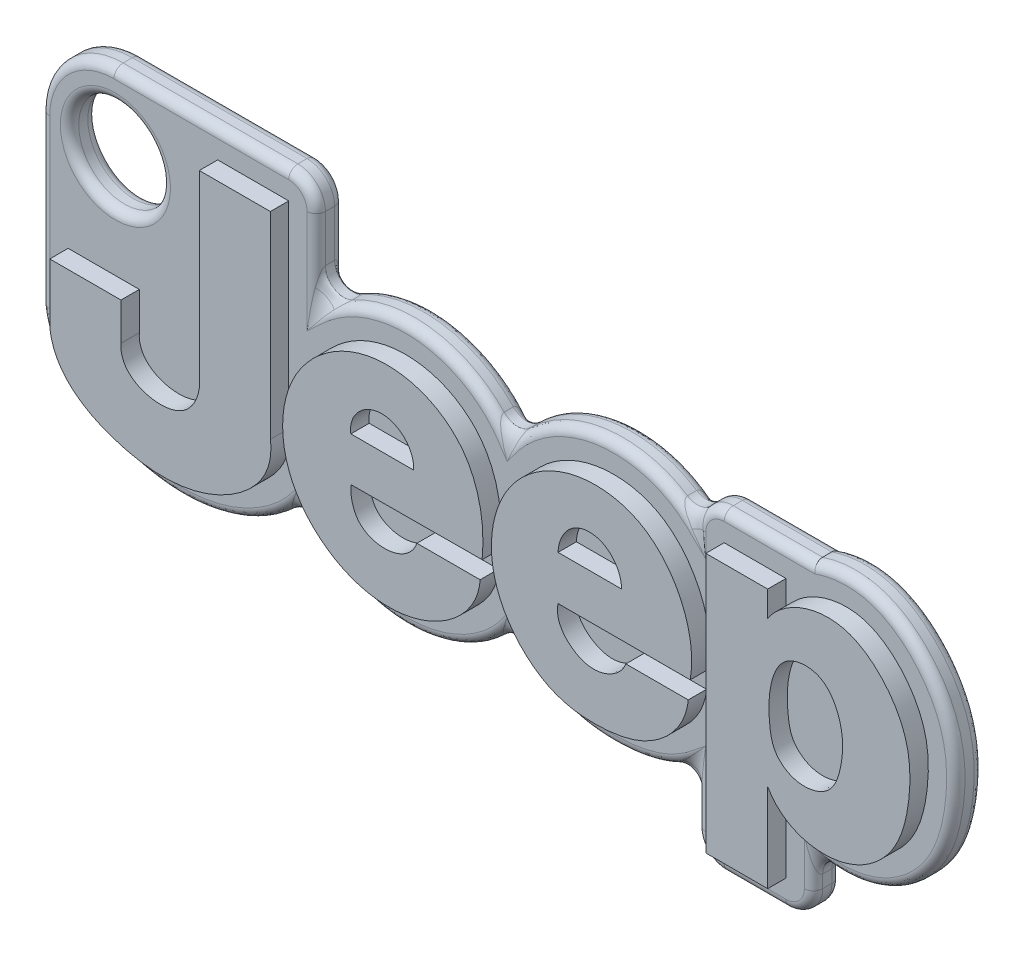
SolidWorks part; units mm, degrees
ref_plane "Front Plane" through (0, 0, 0) normal (0, 0, 1) x (1, 0, 0)
ref_plane "Top Plane" through (0, 0, 0) normal (0, 1, 0) x (1, 0, 0)
ref_plane "Right Plane" through (0, 0, 0) normal (1, 0, 0) x (0, 0, -1)
sketch "Sketch1" plane through (0, 0, 0) normal (0, 0, 1) x (1, 0, 0)
  line L0 (-6.9158, -4.9188) -> (-0.025, -4.9188)
  line L1 (-14.117, -2.9772) -> (0.1939, -2.9168)
  line L2 (-7.2782, 1.8065) -> (-14.117, 1.8065)
  line L3 (-46.9381, -4.6232) -> (-46.9381, 1.9133)
  line L4 (-46.9381, 1.9133) -> (-39.1769, 1.9133)
  line L5 (-39.1769, 1.9133) -> (-39.1769, -2.1628)
  line L6 (-30.6332, -0.8399) -> (-30.6332, 18.4136)
  line L7 (-30.6332, 18.4136) -> (-22.8911, 18.4136)
  line L8 (-22.8911, 18.4136) -> (-22.8911, -3.0998)
  line L9 (8.4713, -2.9168) -> (22.878, -2.9168)
  line L10 (22.6596, -4.9188) -> (15.8616, -4.9188)
  line L11 (8.4713, 1.9133) -> (15.3868, 1.9133)
  line L12 (31.321, -8.7806) -> (31.321, -18.4136)
  line L13 (31.321, -18.4136) -> (24.5768, -18.4136)
  line L14 (24.5768, -18.4136) -> (24.5768, 9.8752)
  line L15 (24.5768, 9.8752) -> (31.321, 9.8752)
  line L16 (31.321, 9.8752) -> (31.321, 7.1086)
  spline S0 degree 3 poles (-30.6332, -0.8399) (-30.4221, -2.2688) (-31.4077, -5.3573) (-36.3466, -6.279) (-39.3453, -4.2998) (-39.1769, -2.1628) knots 0 0 0 0 0.330374 0.593836 1 1 1 1
  spline S1 degree 3 poles (-46.9381, -4.6232) (-46.4241, -8.4498) (-41.2044, -11.7975) (-33.2878, -12.9399) (-26.0748, -10.6122) (-22.4525, -6.3269) (-22.8911, -3.0998) knots 0 0 0 0 0.318472 0.529068 0.727755 1 1 1 1
  spline S2 degree 3 poles (31.321, -8.7806) (33.1212, -11.9269) (39.3662, -13.1777) (45.4753, -8.2712) (46.9381, -2.5728) (46.8713, 3.1598) (44.2067, 7.7727) (38.5619, 11.7479) (33.0618, 9.695) (31.321, 7.1086) knots 0 0 0 0 0.21595 0.335449 0.470104 0.579431 0.697094 0.799007 1 1 1 1
  spline S3 degree 3 poles (31.4262, -2.3864) (31.9115, -5.2692) (34.4806, -7.2129) (38.2522, -6.3533) (39.5583, -2.5222) (39.6461, 1.204) (37.3776, 5.0265) (32.8047, 4.657) (31.3895, 0.7182) (31.4262, -2.3864) (31.9115, -5.2692) (34.4806, -7.2129) knots -0.310097 -0.183567 -0.06713 0 0.09073 0.213643 0.308507 0.458402 0.575215 0.689903 0.816433 0.93287 1 1.09073 1.213643 1.308507 only from (32.0805, -4.9188) to (32.0805, -4.9188)
  spline S4 degree 3 poles (8.4713, 1.9133) (8.5065, 3.1802) (9.6699, 5.4727) (13.7718, 5.777) (15.4072, 3.4271) (15.3868, 1.9133) knots 0 0 0 0 0.356907 0.591257 1 1 1 1
  spline S5 degree 3 poles (8.4713, -2.9168) (8.1574, -4.3629) (9.4161, -6.3621) (12.2253, -7.417) (14.5134, -6.7402) (15.5881, -5.6565) (15.8616, -4.9188) knots 0 0 0 0 0.371572 0.59237 0.786175 1 1 1 1
  spline S6 degree 3 poles (22.6596, -4.9188) (22.4059, -7.8435) (19.0006, -11.4375) (13.041, -12.4615) (8.0717, -12.0352) (3.5598, -8.679) (0.4638, -2.676) (1.9458, 5.5155) (9.0463, 10.8293) (20.117, 10.0961) (23.7002, 1.4966) (22.878, -2.9168) knots 0 0 0 0 0.127269 0.190192 0.266895 0.342175 0.430272 0.556135 0.676481 0.794652 1 1 1 1
  spline S7 degree 3 poles (-6.9158, -4.9188) (-7.4398, -6.4265) (-9.9279, -7.6902) (-13.708, -6.4041) (-14.177, -4.0414) (-14.117, -2.9772) knots 0 0 0 0 0.419153 0.688036 1 1 1 1
  spline S8 degree 3 poles (-14.117, 1.8065) (-14.3085, 3.0246) (-13.2203, 4.9143) (-9.4598, 5.911) (-7.16, 3.7367) (-7.2782, 1.8065) knots 0 0 0 0 0.323502 0.524565 1 1 1 1
  spline S9 degree 3 poles (0.1939, -2.9168) (0.5183, 0.1803) (-0.1978, 5.4292) (-6.095, 10.2199) (-14.1569, 10.9257) (-21.7971, 4.2795) (-21.9145, -6.2752) (-14.1921, -13.081) (-4.583, -12.4295) (-0.1985, -7.6668) (-0.025, -4.9188) knots 0 0 0 0 0.143724 0.209303 0.326872 0.473482 0.606114 0.748422 0.879198 1 1 1 1
sketch "Sketch2" plane through (0, 0, 0) normal (0, 0, 1) x (1, 0, 0)
  line L0 (-49.9381, -4.8238) -> (-49.9381, 13.4136)
  line L1 (21.5768, 9.7154) -> (21.5768, 12.8752)
  line L2 (-41.9381, 21.4136) -> (-19.8911, 21.4136)
  line L7 (-19.8911, 21.4136) -> (-19.8911, 9.4286)
  line L37 (21.5768, 12.8752) -> (34.3108, 12.8752)
  line L38 (21.5768, -21.4136) -> (21.5768, -12.3879)
  line L39 (34.321, -21.4136) -> (21.5768, -21.4136)
  line L40 (34.321, -14.6278) -> (34.321, -21.4136)
  circle A0 centre (-41.7857, 13.1635) radius 5
  arc A1 (-49.9381, 13.4136) -> (-41.9381, 21.4136) centre (-41.9381, 13.4136) cw
  spline S0 degree 3 poles (-21.7564, -9.5707) (-21.009, -10.5635) (-18.864, -12.7467) (-14.5321, -15.1138) (-9.0686, -15.7853) (-4.6077, -14.666) (-1.3908, -12.7423) (0.2549, -11.2207) (1.0535, -10.1802) (1.2469, -9.9021) knots 0.644163 0.644163 0.644163 0.644163 0.686964 0.749425 0.811885 0.874346 0.905576 0.936807 0.947599 0.947599 0.947599 0.947599
  spline S1 degree 3 poles (21.5768, -12.3879) (21.4658, -12.4764) (20.6039, -13.139) (18.8455, -14.1609) (16.2101, -14.9715) (13.6947, -15.2746) (11.1973, -15.2918) (8.5635, -14.922) (5.9139, -13.9416) (3.6258, -12.4365) (2.1447, -11.0055) (1.4108, -10.1127) (1.2469, -9.9021) knots 0.089261 0.089261 0.089261 0.089261 0.093942 0.125137 0.156332 0.187528 0.218723 0.249918 0.281113 0.312308 0.343503 0.352881 0.352881 0.352881 0.352881
  spline S2 degree 3 poles (-21.7564, -9.5707) (-22.1075, -10.0433) (-23.0907, -11.1608) (-25.5671, -13.1555) (-29.344, -14.9365) (-34.2493, -15.7036) (-38.2564, -15.2138) (-41.2896, -14.3244) (-43.5635, -13.3873) (-45.7687, -12.064) (-47.7619, -10.2304) (-49.0463, -8.1955) (-49.6195, -6.5259) (-49.8126, -5.6573) (-49.8883, -5.1947) (-49.9203, -4.9564) (-49.9318, -4.8708) (-49.9381, -4.8238) knots 0.142289 0.142289 0.142289 0.142289 0.18222 0.244798 0.369955 0.495111 0.620268 0.682846 0.745425 0.808003 0.870582 0.93316 0.964449 0.980094 0.987916 0.991827 0.995738 0.995738 0.995738 0.995738
  spline S3 degree 3 poles (0.9756, 7.4606) (1.9417, 8.7805) (4.4552, 11.1815) (8.5242, 12.9521) (12.1731, 13.3997) (14.9275, 13.2117) (17.6212, 12.4678) (19.8966, 11.2079) (21.1082, 10.1774) (21.5768, 9.7154) knots 0.567998 0.567998 0.567998 0.567998 0.62426 0.68665 0.717845 0.74904 0.780235 0.81143 0.833791 0.833791 0.833791 0.833791
  spline S7 degree 3 poles (0.9756, 7.4606) (0.6216, 8.0061) (-0.3471, 9.2785) (-2.9406, 11.5446) (-7.2533, 13.3513) (-11.8559, 13.401) (-15.4109, 12.3731) (-17.8199, 11.1245) (-19.2411, 10.0281) (-19.8911, 9.4286) knots 0.134172 0.134172 0.134172 0.134172 0.156048 0.187278 0.249739 0.3122 0.34343 0.37466 0.405201 0.405201 0.405201 0.405201
  spline S17 degree 3 poles (34.321, -14.6278) (35.3436, -14.93) (37.4994, -15.2213) (40.6676, -14.7797) (43.6168, -13.4755) (46.0392, -11.523) (47.9049, -9.011) (49.0317, -6.2822) (49.6248, -3.5451) (49.883, -0.8979) (49.8044, 1.9167) (49.1195, 4.8303) (47.8072, 7.4909) (46.0067, 9.8179) (43.7314, 11.8101) (41.2933, 13.0285) (39.0838, 13.4659) (36.909, 13.5297) (35.3213, 13.2201) (34.3108, 12.8752) knots 0.104882 0.104882 0.104882 0.104882 0.154223 0.203564 0.252905 0.302246 0.351588 0.400929 0.45027 0.499611 0.548952 0.598293 0.647634 0.696976 0.746317 0.795658 0.820328 0.844999 0.89434 0.89434 0.89434 0.89434
  dimension "D1" = 8
extrude "Boss-Extrude1" add sketch "Sketch1" along normal blind 2
extrude "Boss-Extrude2" add sketch "Sketch2" against normal blind 3
fillet "Fillet1" radius 1 32 edges at (-49.9381, 4.2949, 0) (-47.595, 19.0705, 0) (-49.9381, 4.2949, -3) (21.5768, -16.9008, -3) (27.9489, -21.4136, -3) (34.321, -18.0207, -3) (27.9438, 12.8752, -3) (21.5768, 11.2953, -3) (-19.8911, 15.4211, -3) (-30.9146, 21.4136, -3) (-47.595, 19.0705, -3) (-36.7857, 13.1635, -3) (21.5768, -16.9008, 0) (27.9489, -21.4136, 0) (34.321, -18.0207, 0) (27.9438, 12.8752, 0) (21.5768, 11.2953, 0) (-19.8911, 15.4211, 0) (-30.9146, 21.4136, 0) (-36.7857, 13.1635, 0)
fillet "Fillet2" radius 3 12 edges at (-20.184, 21.1207, -0.2929) (-20.184, 21.1207, -2.7071) (21.8697, 12.5823, -0.2929) (21.8697, 12.5823, -2.7071) (21.8697, -21.1207, -0.2929) (21.8697, -21.1207, -2.7071) (34.0281, -21.1207, -0.2929) (34.0281, -21.1207, -2.7071) (34.321, -21.4136, -1.5) (21.5768, -21.4136, -1.5) (21.5768, 12.8752, -1.5) (-19.8911, 21.4136, -1.5)
fillet "Fillet3" radius 2 21 edges at (0.9708, 7.2881, -2.4316) (0.9708, 7.2881, -0.5684) (21.6218, 9.608, -2.2965) (21.6218, 9.608, -0.7035) (-19.9391, 9.3189, -2.3063) (-19.9391, 9.3189, -0.6937) (21.6319, -12.2736, -2.3274) (21.6319, -12.2736, -0.6726) (-21.7569, -9.3966, -2.4446) (-21.7569, -9.3966, -0.5554) (1.2422, -9.7284, -2.442) (1.2422, -9.7284, -0.558) (34.2168, -14.4884, -2.4444) (34.2168, -14.4884, -0.5556) (0.9756, 7.4606, -1.5) (21.5768, 9.7154, -1.5) (-19.8911, 9.4286, -1.5) (21.5768, -12.3879, -1.5) (-21.7564, -9.5707, -1.5) (1.2469, -9.9021, -1.5) (34.321, -14.6278, -1.5)
